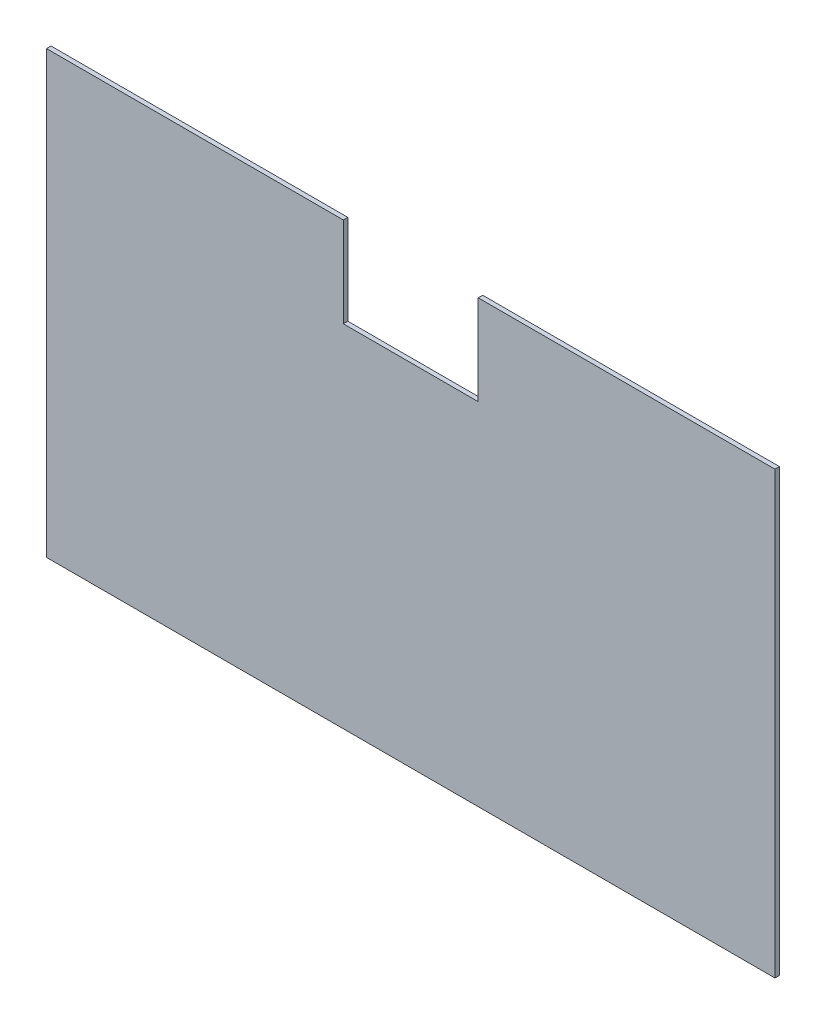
SolidWorks part; units mm, degrees
ref_plane "Front" through (0, 0, 0) normal (0, 0, 1) x (1, 0, 0)
ref_plane "Top" through (0, 0, 0) normal (0, 1, 0) x (1, 0, 0)
ref_plane "Right" through (0, 0, 0) normal (1, 0, 0) x (0, 0, -1)
sketch "草图1" plane through (0, 0, 0) normal (0, 0, 1) x (1, 0, 0)
  line L0 (-72.785, 24.7707) -> (-6.785, 24.7707)
  line L2 (-72.785, 24.7707) -> (-72.785, -73.2293)
  line L3 (-72.785, -73.2293) -> (89.215, -73.2293)
  line L4 (89.215, 24.7707) -> (89.215, -73.2293)
  line L6 (-6.785, 24.7707) -> (-6.785, 4.7707)
  line L7 (-6.785, 4.7707) -> (23.215, 4.7707)
  line L8 (23.215, 24.7707) -> (23.215, 4.7707)
  line L9 (23.215, 24.7707) -> (89.215, 24.7707)
  point P8 (-6.785, 14.7707)
  dimension "D1" = 162
  dimension "D2" = 98
  dimension "D3" = 66
  dimension "D4" = 66
  dimension "D5" = 20
extrude "凸台-拉伸1" add sketch "草图1" along normal blind 1
